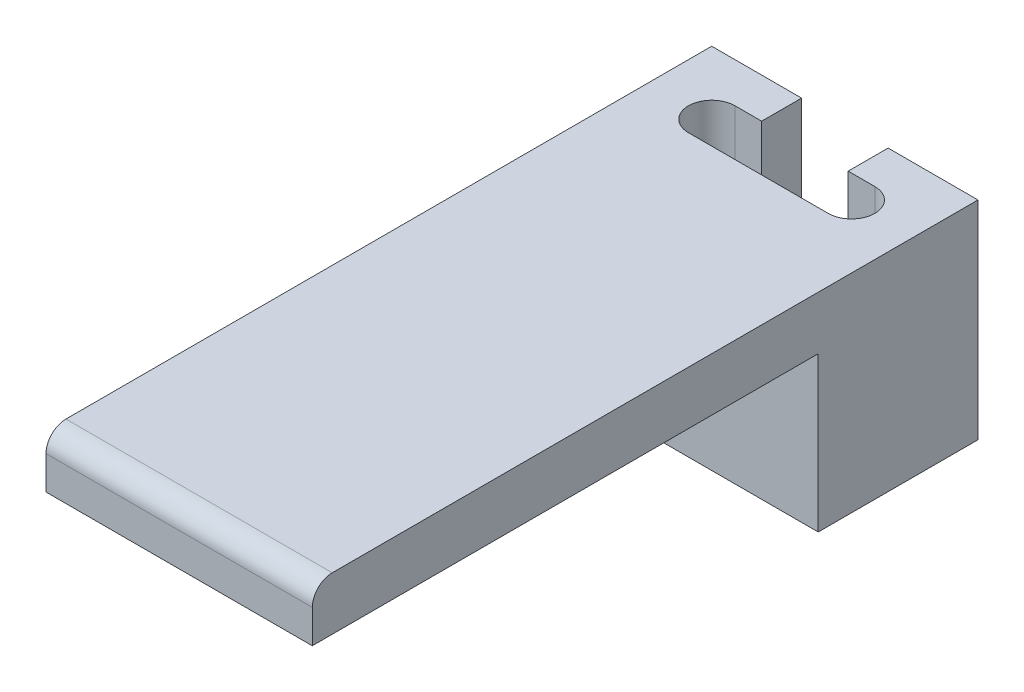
SolidWorks part; units mm, degrees
ref_plane "前视基准面" through (0, 0, 0) normal (0, 0, 1) x (1, 0, 0)
ref_plane "上视基准面" through (0, 0, 0) normal (0, 1, 0) x (1, 0, 0)
ref_plane "右视基准面" through (0, 0, 0) normal (1, 0, 0) x (0, 0, -1)
sketch "草图1" plane through (0, 0, 0) normal (0, 0, 1) x (1, 0, 0)
  line L0 (0, 0) -> (0, 15.6)
  line L1 (20, 0) -> (20, 15.6)
  line L2 (0, 15.6) -> (20, 15.6)
  line L3 (0, 0) -> (20, 0)
extrude "凸台-拉伸1" add sketch "草图1" along normal blind 50
sketch "草图2" plane through (20, 0, 0) normal (1, 0, 0) x (0, 0, -1)
  line L0 (-48.5, 15.6) -> (0, 15.6)
  line L1 (-50, 11.6) -> (-12, 11.6)
  line L2 (-50, 11.6) -> (-50, 14.1)
  line L3 (0, 0) -> (0, 15.6)
  line L4 (-12, 0) -> (0, 0)
  line L5 (-12, 0) -> (-12, 11.6)
  arc A0 (-48.5, 15.6) -> (-50, 14.1) centre (-48.5, 14.1) ccw
extrude "切除-拉伸1" cut sketch "草图2" against normal blind 50 flip side to cut
sketch "草图3" plane through (0, 15.6, 0) normal (0, 1, 0) x (1, 0, 0)
  line L0 (0, -50) -> (20, -50)
  line L1 (0, 0) -> (6.75, 0)
  line L2 (0, -50) -> (0, 0)
  line L3 (20, -50) -> (20, 0)
  line L4 (4.75, -3) -> (6.75, -3)
  line L5 (4.75, -6.5) -> (15.25, -6.5)
  line L6 (6.75, -3) -> (6.75, 0)
  line L7 (13.25, 0) -> (13.25, -3)
  line L8 (13.25, 0) -> (20, 0)
  line L9 (13.25, -3) -> (15.25, -3)
  arc A0 (4.75, -3) -> (4.75, -6.5) centre (4.75, -4.75) ccw
  arc A1 (15.25, -6.5) -> (15.25, -3) centre (15.25, -4.75) ccw
extrude "切除-拉伸2" cut sketch "草图3" against normal blind 50 flip side to cut
